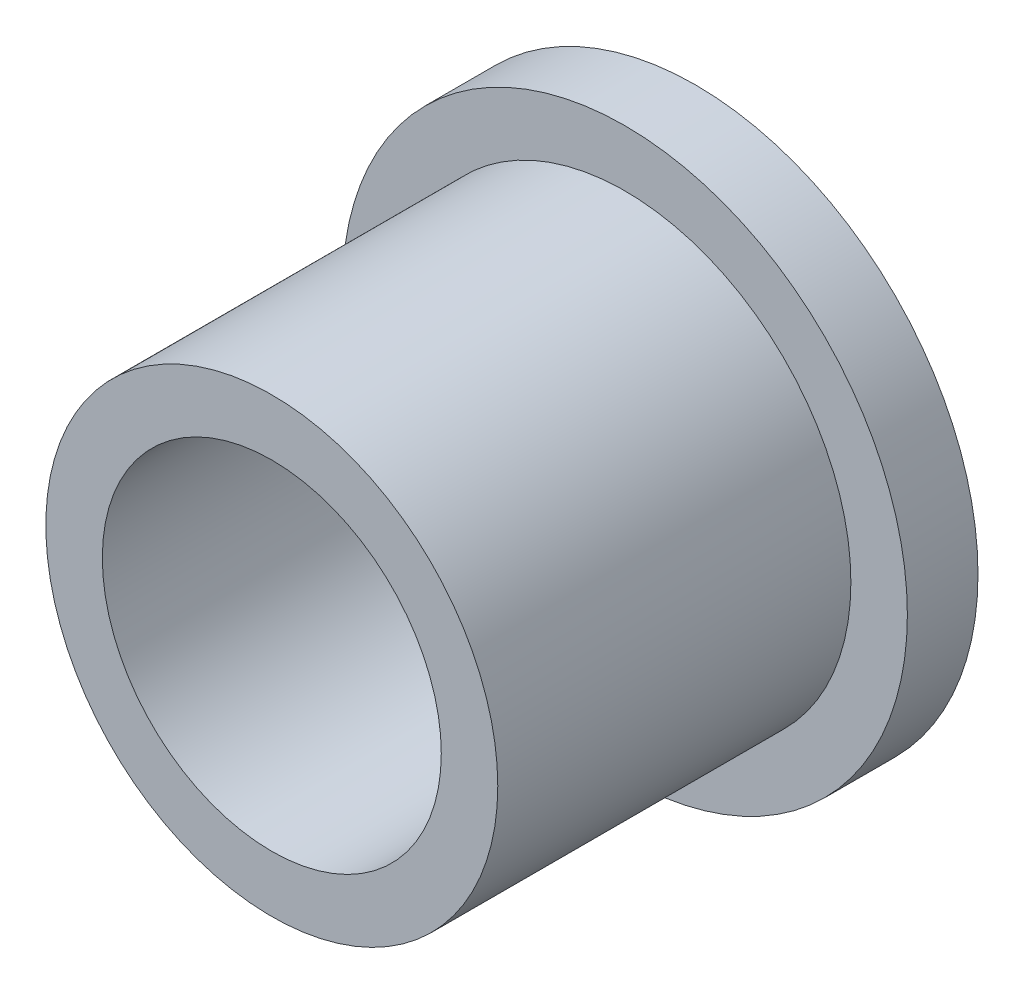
SolidWorks part; units mm, degrees
ref_plane "Front" through (0, 0, 0) normal (0, 0, 1) x (1, 0, 0)
ref_plane "Top" through (0, 0, 0) normal (0, 1, 0) x (1, 0, 0)
ref_plane "Right" through (0, 0, 0) normal (1, 0, 0) x (0, 0, -1)
sketch "Sketch1" plane through (0, 0, 0) normal (0, 0, 1) x (1, 0, 0)
  circle A0 centre (0, 0) radius 20
extrude "Extrude1" add sketch "Sketch1" along normal blind 5
sketch "Sketch2" plane through (0, 0, 5) normal (0, 0, 1) x (1, 0, 0)
  circle A0 centre (0, 0) radius 16
extrude "Extrude2" add sketch "Sketch2" along normal blind 25
sketch "Sketch3" plane through (0, 0, 0) normal (0, 0, -1) x (-1, 0, 0)
  circle A0 centre (0, 0) radius 12
extrude "Cut-Extrude1" cut sketch "Sketch3" against normal through all
